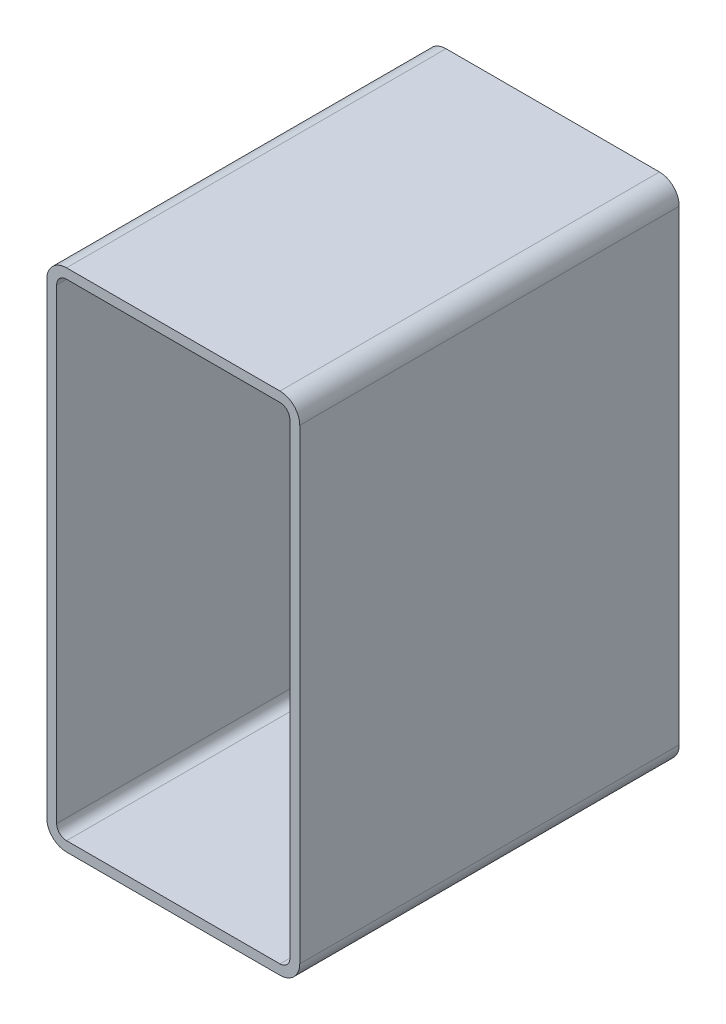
SolidWorks part; units mm, degrees
ref_plane "Front Plane" through (0, 0, 0) normal (0, 0, 1) x (1, 0, 0)
ref_plane "Top Plane" through (0, 0, 0) normal (0, 1, 0) x (1, 0, 0)
ref_plane "Right Plane" through (0, 0, 0) normal (1, 0, 0) x (0, 0, -1)
sketch "Sketch1" plane through (0, 0, 0) normal (0, 0, 1) x (1, 0, 0)
sketch_block_instance "HSS16x8x0.3125-1"
sketch_block "HSS16x8x0.3125"
extrude "Boss-Extrude1" add sketch "Sketch1" along normal blind 304.8
